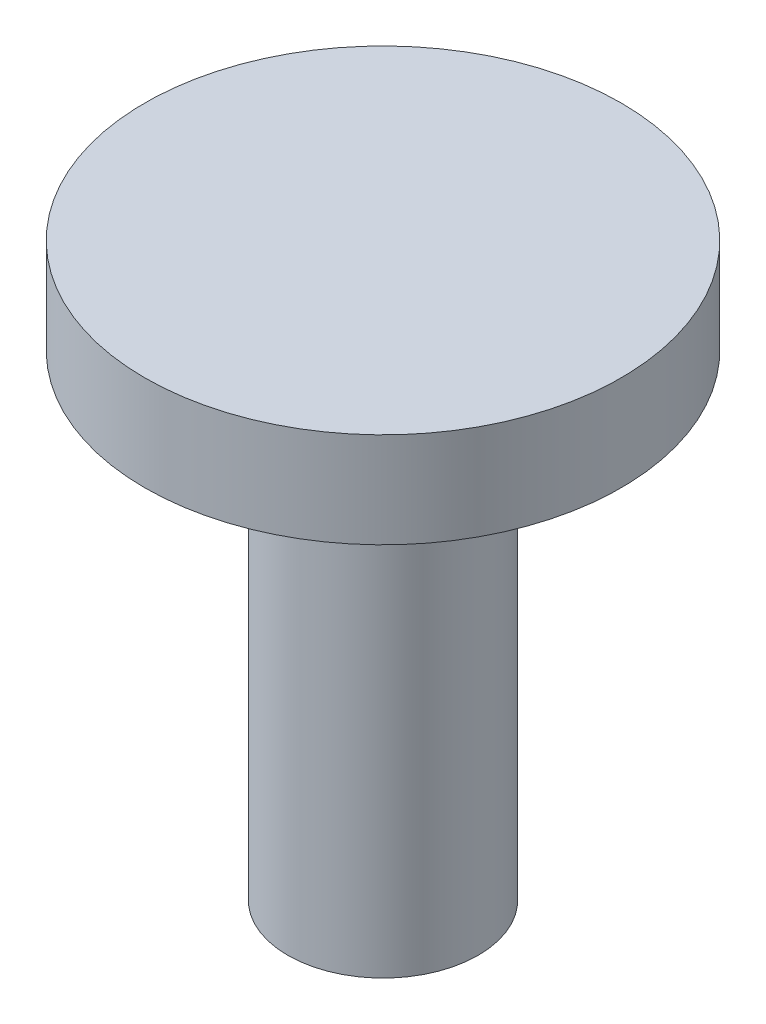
SolidWorks part; units mm, degrees
ref_plane "Front Plane" through (0, 0, 0) normal (0, 0, 1) x (1, 0, 0)
ref_plane "Top Plane" through (0, 0, 0) normal (0, 1, 0) x (1, 0, 0)
ref_plane "Right Plane" through (0, 0, 0) normal (1, 0, 0) x (0, 0, -1)
sketch "Sketch1" plane through (0, 0, 0) normal (0, 1, 0) x (1, 0, 0)
  circle A0 centre (0, 0) radius 2.5
  dimension "D1" = 5
extrude "Boss-Extrude1" add sketch "Sketch1" along normal blind 1
sketch "Sketch2" plane through (0, 0, 0) normal (0, -1, 0) x (1, 0, 0)
  circle A0 centre (0, 0) radius 1
  dimension "D1" = 2
extrude "Boss-Extrude2" add sketch "Sketch2" along normal blind 5
